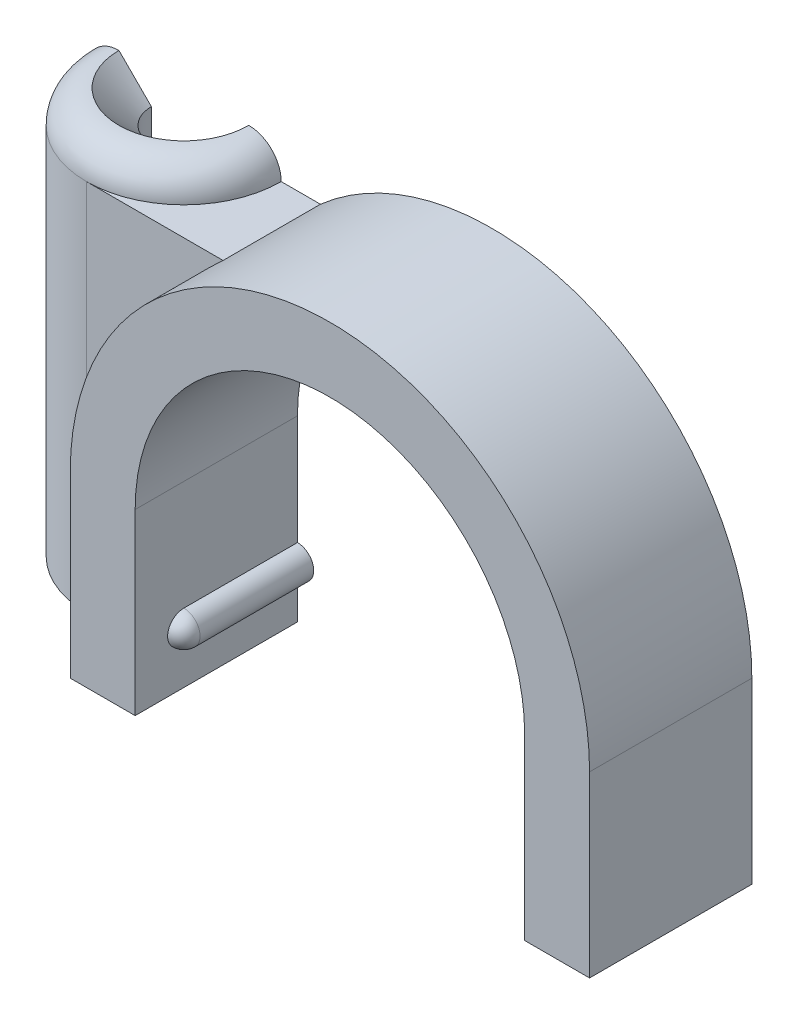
SolidWorks part; units mm, degrees
ref_plane "face" through (0, 0, 0) normal (0, 0, 1) x (1, 0, 0)
ref_plane "dessus" through (0, 0, 0) normal (0, 1, 0) x (1, 0, 0)
ref_plane "profil" through (0, 0, 0) normal (1, 0, 0) x (0, 0, -1)
sketch "Esquisse1" plane through (0, 0, 0) normal (0, 0, 1) x (1, 0, 0)
  line L0 (14, 0) -> (14, 5.5)
  line L1 (2, 0) -> (2, 5.5)
  line L2 (0, 0) -> (0, 5.5)
  line L3 (0, 0) -> (2, 0)
  line L4 (16, 0) -> (16, 5.5)
  line L5 (14, 0) -> (16, 0)
  arc A0 (0, 5.5) -> (16, 5.5) centre (8, 5.5) cw
  arc A1 (2, 5.5) -> (14, 5.5) centre (8, 5.5) cw
  dimension "D4" = 2
  dimension "D3" = 5.5
  dimension "D1" = 16
  dimension "D2" = 5.5
extrude "Base-Extrusion" add sketch "Esquisse1" against normal blind 10
sketch "Esquisse10" plane through (0, 0, 0) normal (0, -1, 0) x (1, 0, 0)
  line L0 (14, 0) -> (2, 0) construction
  line L1 (2, -10) -> (2, 0) construction
  circle A0 centre (-1.5, -5) radius 3
  dimension "D1" = 6
  dimension "D2" = 5
  dimension "D3" = 3.5
extrude "Boss.-Extru.5" add sketch "Esquisse10" against normal blind 12.5
ref_plane "Plan1" through (-1.5, 0, 0) normal (1, 0, 0) x (0, 0, -1)
sketch "Esquisse4" plane through (-1.5, 0, 0) normal (1, 0, 0) x (0, 0, -1)
  line L0 (10, 5.5) -> (10, 0) construction
  line L1 (8, 0) -> (2, 0)
  line L2 (8, 0) -> (8, 11.5)
  line L3 (8, 11.5) -> (2, 11.5)
  line L4 (2, 0) -> (2, 11.5)
  dimension "D1" = 11.5
  dimension "D2" = 6
  dimension "D3" = 2
extrude "Boss.-Extru.3" add sketch "Esquisse4" along normal up to next
ref_plane "Plan2" through (0, 0, -5) normal (0, 0, 1) x (1, 0, 0)
fillet "Congé3" radius 1
hole_wizard "Perçage1" positions "Esquisse12" profile "Esquisse11" countersink size "M2" standard "Ansi Métrique"
sketch "Esquisse12" plane through (0, 12.5, 0) normal (0, 1, 0) x (-1, 0, 0)
  point P0 (1.5, -5)
sketch "Esquisse11" plane through (-1.5, 12.5, -5) normal (1, 0, 0) x (0, 0, 1)
  line L0 (0, 0) -> (0, 12.5)
  line L1 (0, 12.5) -> (1, 12.5)
  line L2 (1, 12.5) -> (1, 1)
  line L3 (1, 1) -> (2, 0)
  line L5 (2, 0) -> (0, 0)
  line L6 (-1, 1) -> (-2, 0) construction
  line L11 (0, -6.35) -> (0, 107.95) construction
  dimension "Diamètre du perçage jusqu'au prochain" = 2
  dimension "Profondeur du perçage jusqu'au prochain" = 12.5
  dimension "Diamètre du fraisage entrant" = 4
  dimension "Angle du fraisage entrant" = 90
sketch "Esquisse9" plane through (0, 0, -5) normal (0, 0, 1) x (1, 0, 0)
  line L4 (2, 0) -> (2, 5.5) construction
  line L6 (2, 2.1191) -> (2, 1.1191)
  arc A0 (2, 1.1191) -> (2, 2.1191) centre (2, 1.6191) ccw
  dimension "D1" = 1
extrude "Boss.-Extru.4" add sketch "Esquisse9" along normal mid plane 8
fillet "Congé5" radius 0.5
ref_plane "Plan3" through (8, 0, 0) normal (-1, 0, 0) x (0, 0, 1)
mirror "Symétrie1" about plane through (8, 0, 0) normal (-1, 0, 0)
sketch "Esquisse13" plane through (0, 0, -5) normal (0, 0, 1) x (1, 0, 0)
  line L1 (-5.4623, -0.7543) -> (16.874, -0.7543)
  line L2 (-5.4623, -0.7543) -> (-5.4623, 13.9012)
  line L3 (-5.4623, 13.9012) -> (16.874, 13.9012)
  line L4 (16.874, -0.7543) -> (16.874, 13.9012)
extrude "Enlèv. mat.-Extru.1" cut sketch "Esquisse13" against normal up to next
